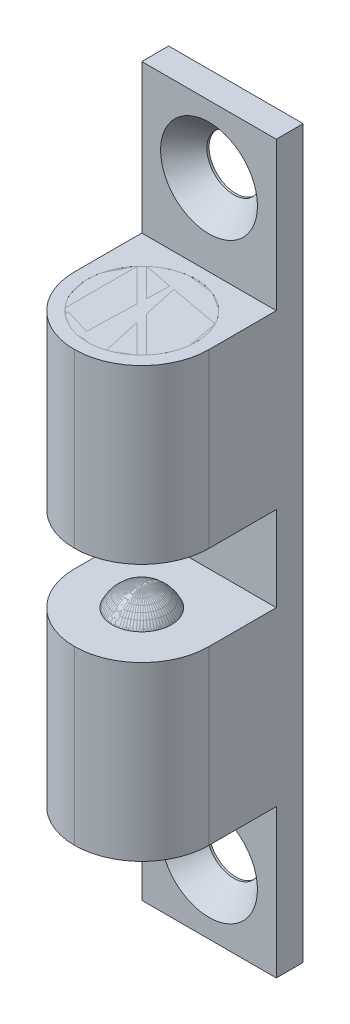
SolidWorks part; units mm, degrees
ref_plane "Front Plane" through (0, 0, 0) normal (0, 0, 1) x (1, 0, 0)
ref_plane "Top Plane" through (0, 0, 0) normal (0, 1, 0) x (1, 0, 0)
ref_plane "Right Plane" through (0, 0, 0) normal (1, 0, 0) x (0, 0, -1)
sketch "Sketch1" plane through (0, 0, 0) normal (1, 0, 0) x (0, 0, -1)
  line L0 (0, 0) -> (-1.5875, 0) construction
  line L1 (0, -21.4312) -> (0, 21.4312)
  line L2 (0, 21.4312) -> (-1.5875, 21.4312)
  line L3 (-1.5875, -2.5082) -> (-1.5875, 2.5082)
  line L4 (-1.5875, 2.5082) -> (-9.525, 2.5082)
  line L6 (-1.5875, 12.6683) -> (-9.525, 12.6682)
  line L7 (-9.525, 2.5082) -> (-9.525, 12.6682)
  line L8 (-1.5875, 12.6683) -> (-1.5875, 21.4312)
  line L9 (-1.5875, -12.6683) -> (-1.5875, -21.4312)
  line L10 (-9.525, -2.5083) -> (-9.525, -12.6683)
  line L11 (-1.5875, -12.6683) -> (-9.525, -12.6683)
  line L12 (-1.5875, -2.5082) -> (-9.525, -2.5083)
  line L13 (0, -21.4312) -> (-1.5875, -21.4312)
  dimension "D1" = 21.4312
  dimension "D2" = 1.5875
  dimension "D3" = 9.525
  dimension "D4" = 8.763
  dimension "D5" = 10.16
extrude "Boss-Extrude1" add sketch "Sketch1" along normal mid plane 7.9375
sketch "Sketch2" plane through (0, 0, 0) normal (1, 0, 0) x (0, 0, -1)
  line L1 (-9.525, 2.5082) -> (-1.5875, 2.5082) construction
  line L2 (-3.6513, 3.2702) -> (-7.4612, 3.2702)
  arc A0 (-7.4612, 3.2702) -> (-3.6513, 3.2702) centre (-5.5563, 3.2702) ccw construction
  arc A1 (-7.4612, 3.2702) -> (-3.6513, 3.2702) centre (-5.5563, 3.2702) ccw
  point P4 (-5.5563, 2.5082)
  point P8 (-5.5563, 3.2702)
  dimension "D1" = 3.81
  dimension "D2" = 0.762
revolve "Revolve1" add sketch "Sketch2" angle 360 about L2
mirror "Mirror1" about plane through (0, 0, 0) normal (0, 1, 0) of "Revolve1"
hole_wizard "CSK for #4 Flat Head Machine Screw1" positions "Sketch3" profile "Sketch4" countersink size "#4" standard "ANSI Inch"
sketch "Sketch3" plane through (0, 0, 1.5875) normal (0, 0, 1) x (1, 0, 0)
  line L0 (3.9688, 21.4312) -> (-3.9688, 21.4312) construction
  line L1 (3.9688, -21.4312) -> (-3.9688, -21.4312) construction
  point P0 (0, 17.4625)
  point P2 (0, -17.4625)
  point P7 (0, 21.4312)
  dimension "D1" = 3.9688
  dimension "D2" = 3.9688
sketch "Sketch4" plane through (0, 17.4625, 1.5875) normal (1, 0, 0) x (0, -1, 0)
  line L0 (0, 0) -> (0, 1.5875)
  line L1 (0, 1.5875) -> (1.5875, 1.5875)
  line L2 (1.5875, 1.5875) -> (1.5875, 1.461)
  line L3 (1.5875, 1.461) -> (2.8575, 0)
  line L5 (2.8575, 0) -> (0, 0)
  line L6 (-1.5875, 1.461) -> (-2.8575, 0) construction
  line L11 (0, -6.35) -> (0, 107.95) construction
  dimension "Thru Hole Dia." = 3.175
  dimension "Thru Hole Depth" = 1.5875
  dimension "Near C'Sink Dia." = 5.715
  dimension "Near C'Sink Angle" = 82
fillet "Fillet1" radius 3.9688 4 edges at (-3.9688, 7.5882, 9.525) (3.9688, 7.5882, 9.525) (-3.9688, -7.5883, 9.525) (3.9688, -7.5883, 9.525)
sketch "Sketch5" plane through (0, -12.6683, 0) normal (0, -1, 0) x (1, 0, 0)
  circle A2 centre (0, 5.5562) radius 1.746 construction
  circle A3 centre (0, 5.5562) radius 1.746
extrude "Cut-Extrude1" cut sketch "Sketch5" against normal up to surface (10.16 mm away)
sketch "Sketch6" plane through (0, 12.6683, 0) normal (0, 1, 0) x (1, 0, 0)
  circle A2 centre (0, -5.5562) radius 1.746 construction
  circle A3 centre (0, -5.5562) radius 1.746
extrude "Cut-Extrude2" cut sketch "Sketch6" against normal up to surface (10.16 mm away)
sketch "Sketch7" plane through (0, 12.6683, 0) normal (0, 1, 0) x (1, 0, 0)
  circle A0 centre (0, -5.5562) radius 3.2096
extrude "Cut-Extrude3" cut sketch "Sketch7" against normal blind 0.635
sketch "Sketch8" plane through (0, -12.6683, 0) normal (0, -1, 0) x (1, 0, 0)
  circle A0 centre (0, 5.5562) radius 3.2096 construction
  circle A1 centre (0, 5.5562) radius 3.2096
extrude "Cut-Extrude4" cut sketch "Sketch8" against normal blind 0.635
sketch "Sketch9" plane through (0, 0, 0) normal (1, 0, 0) x (0, 0, -1)
  line L0 (-2.3467, 12.0332) -> (-2.3467, 12.6682)
  line L1 (-2.3467, 12.6682) -> (-5.5563, 12.6682)
  line L2 (-5.5563, 12.6682) -> (-5.5563, 2.5082)
  line L3 (-5.5563, 2.5082) -> (-3.8103, 2.5082)
  line L4 (-3.8103, 2.5082) -> (-3.8103, 12.0332)
  line L5 (-3.8103, 12.0332) -> (-2.3467, 12.0332)
  line L6 (-2.3467, -12.0333) -> (-2.3467, -12.6683)
  line L7 (-2.3467, -12.6683) -> (-5.5562, -12.6683)
  line L8 (-5.5562, -12.6683) -> (-5.5563, -2.5082)
  line L9 (-5.5563, -2.5082) -> (-3.8103, -2.5082)
  line L10 (-3.8103, -2.5082) -> (-3.8103, -12.0333)
  line L11 (-3.8103, -12.0333) -> (-2.3467, -12.0333)
revolve "Revolve2" add sketch "Sketch9" angle 360 about L8
sketch "Sketch10" plane through (0, -12.6683, 0) normal (0, -1, 0) x (1, 0, 0)
  line L0 (0, 8.7658) -> (0, 5.5563) construction
  line L1 (-2.2695, 3.2867) -> (2.2695, 7.8258) construction
  line L2 (0, 5.5563) -> (-3.2096, 5.5563) construction
  line L3 (-2.1308, 3.156) -> (2.4002, 7.6871)
  line L4 (0, 5.5563) -> (2.2695, 7.8258) construction
  line L5 (0.1347, 5.4215) -> (2.4042, 7.6911) construction
  line L6 (-2.4002, 3.4254) -> (2.1308, 7.9565)
  circle A0 centre (0, 5.5563) radius 3.2096 construction
  arc A1 (2.4002, 7.6871) -> (2.1308, 7.9565) centre (0, 5.5563) ccw construction
  arc A2 (-2.4002, 3.4254) -> (-2.1308, 3.156) centre (0, 5.5563) ccw construction
  arc A3 (2.1308, 7.9565) -> (2.4002, 7.6871) centre (0, 5.5563) cw
  dimension "D1" = 45
  dimension "D2" = 0.1905
extrude "Cut-Extrude5" cut sketch "Sketch10" against normal blind 0.0254 and the other way through all contours L6 L3 M7
mirror "Mirror3" about plane through (0, 0, 0) normal (0, 1, 0)
mirror "Mirror4" about plane through (0, 0, 0) normal (0, 1, 0)
